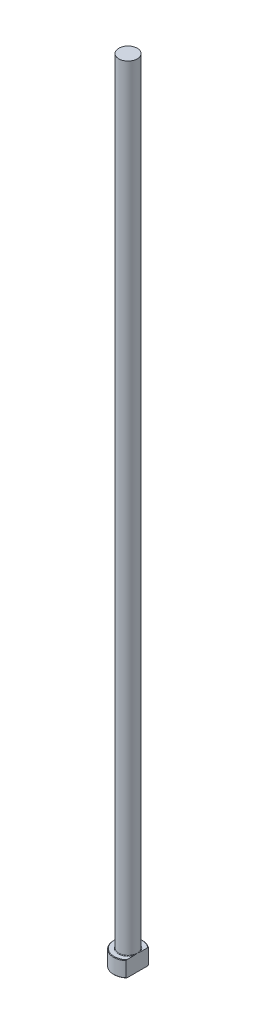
SolidWorks part; units mm, degrees
ref_plane "Front Plane" through (0, 0, 0) normal (0, 0, 1) x (1, 0, 0)
ref_plane "Top Plane" through (0, 0, 0) normal (0, 1, 0) x (1, 0, 0)
ref_plane "Right Plane" through (0, 0, 0) normal (1, 0, 0) x (0, 0, -1)
sketch "Sketch1" plane through (0, 0, 0) normal (0, 0, 1) x (1, 0, 0)
  line L0 (0, 259.9588) -> (0, -15.1925) construction
  line L1 (0, 0) -> (-5.5, 0)
  line L2 (-5.5, 0) -> (-5.5, 6)
  line L3 (-5.5, 6) -> (-3.5, 6)
  line L4 (-3.5, 6) -> (-3.5, 300)
  line L5 (-3.5, 300) -> (0, 300)
  line L6 (0, 300) -> (0, 0)
  dimension "L" = 300
  dimension "H" = 11
  dimension "T" = 6
  dimension "D" = 7
revolve "Revolve1" add sketch "Sketch1" angle 360 about L0
chamfer "Chamfer1" distance 0.2 angle 45 2 edges at (0, 6, 5.5) (0, 0, 5.5)
fillet "Fillet1" radius 0.2 1 edges at (0, 6, 3.5)
sketch "Sketch2" plane through (0, 0, 0) normal (0, 1, 0) x (1, 0, 0)
  line L0 (3.5, -4.2426) -> (3.5, 4.2426)
  circle A0 centre (0, 0) radius 5.5 construction
  arc A1 (3.5, -4.2426) -> (3.5, 4.2426) centre (0, 0) ccw
  circle A2 centre (0, 0) radius 3.5 construction
extrude "KEYED HEAD" cut sketch "Sketch2" along normal through all
